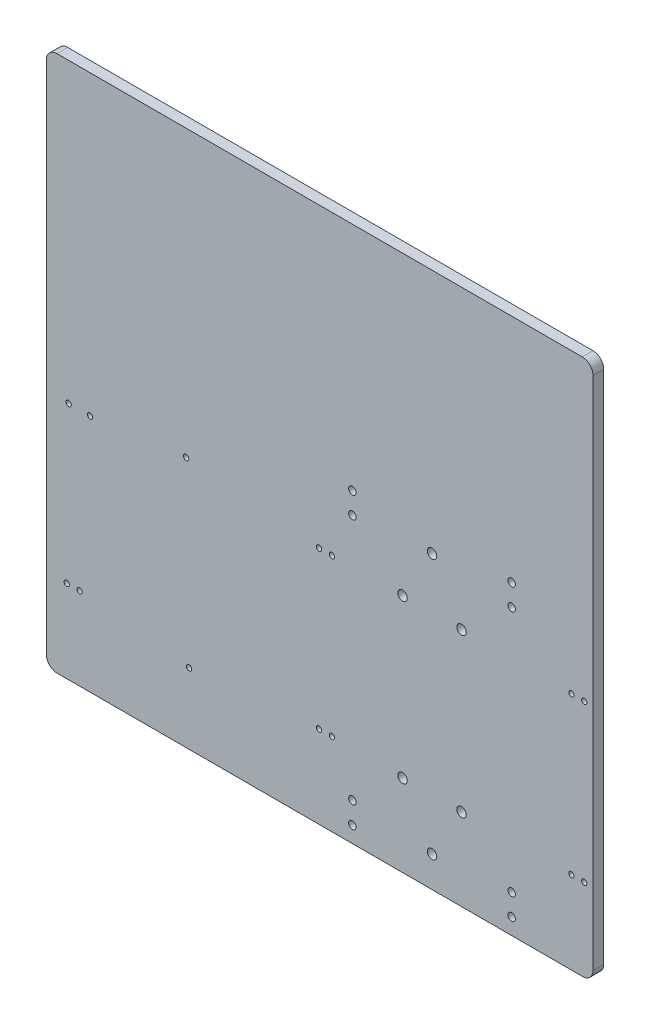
SolidWorks part; units mm, degrees
ref_plane "Front Plane" through (0, 0, 0) normal (0, 0, 1) x (1, 0, 0)
ref_plane "Top Plane" through (0, 0, 0) normal (0, 1, 0) x (1, 0, 0)
ref_plane "Right Plane" through (0, 0, 0) normal (1, 0, 0) x (0, 0, -1)
sketch "Sketch1" plane through (0, 0, 0) normal (0, 0, 1) x (1, 0, 0)
  line L0 (50.8, 9.525) -> (50.8, 290.475)
  line L1 (50.8, 290.475) -> (50.8, 500)
  line L2 (41.275, 0) -> (-458.725, 0)
  line L3 (41.275, 0) -> (41.275, 500)
  line L4 (41.275, 500) -> (-458.725, 500)
  line L5 (-458.725, 0) -> (-458.725, 500)
  line L6 (50.8, 77) -> (-559.8128, 77) construction
  line L7 (50.8, 223) -> (-544.063, 223) construction
  line L8 (50.8, 500) -> (41.275, 500)
  arc A3 (41.275, 0) -> (50.8, 9.525) centre (41.275, 9.525) ccw
  circle A7 centre (-173.4, 35) radius 3.5
  circle A8 centre (-173.4, 15) radius 3.5
  circle A9 centre (-71.7037, 223.625) radius 4.4005
  circle A10 centre (-99.2, 271.25) radius 4.4006
  circle A11 centre (-126.6963, 223.625) radius 4.4005
  circle A12 centre (-71.7037, 76.375) radius 4.4005
  circle A13 centre (-99.2, 28.75) radius 4.4005
  circle A14 centre (-126.6963, 76.375) radius 4.4005
  circle A15 centre (-25, 15) radius 3.5
  circle A16 centre (-25, 35) radius 3.5
  circle A17 centre (-173.4, 265) radius 3.5
  circle A18 centre (-173.4, 285) radius 3.5
  circle A40 centre (-437.9309, 223) radius 2.4892
  circle A41 centre (-417.9309, 223) radius 2.4892
  circle A42 centre (-439.725, 77) radius 2.4892
  circle A43 centre (-427.725, 77) radius 2.4765
  circle A44 centre (-204.5062, 223) radius 2.4765
  circle A45 centre (-192.5062, 223) radius 2.4892
  circle A46 centre (-204.5063, 77) radius 2.4892
  circle A47 centre (-192.5063, 77) radius 2.4765
  circle A48 centre (-325.6523, 65.8) radius 2.4892
  circle A55 centre (30.7125, 77) radius 2.4892
  circle A56 centre (42.7125, 77) radius 2.4765
  circle A57 centre (42.7125, 223) radius 2.4892
  circle A58 centre (30.7125, 223) radius 2.4765
  circle A59 centre (-25, 285) radius 3.5
  circle A60 centre (-25, 265) radius 3.5
  circle A63 centre (-328.4265, 234.2) radius 2.4892
  point P8 (-208.725, 250)
  point P34 (0, 0)
  point P38 (-437.7977, 223)
  point P48 (-417.9309, 223)
  dimension "D1" = 500
  dimension "D2" = 500
  dimension "D3" = 20
extrude "Boss-Extrude1" add sketch "Sketch1" along normal blind 10
fillet "Fillet1" radius 10 3 edges at (50.8, 500, 5) (-458.725, 500, 5) (-458.725, 0, 5)
